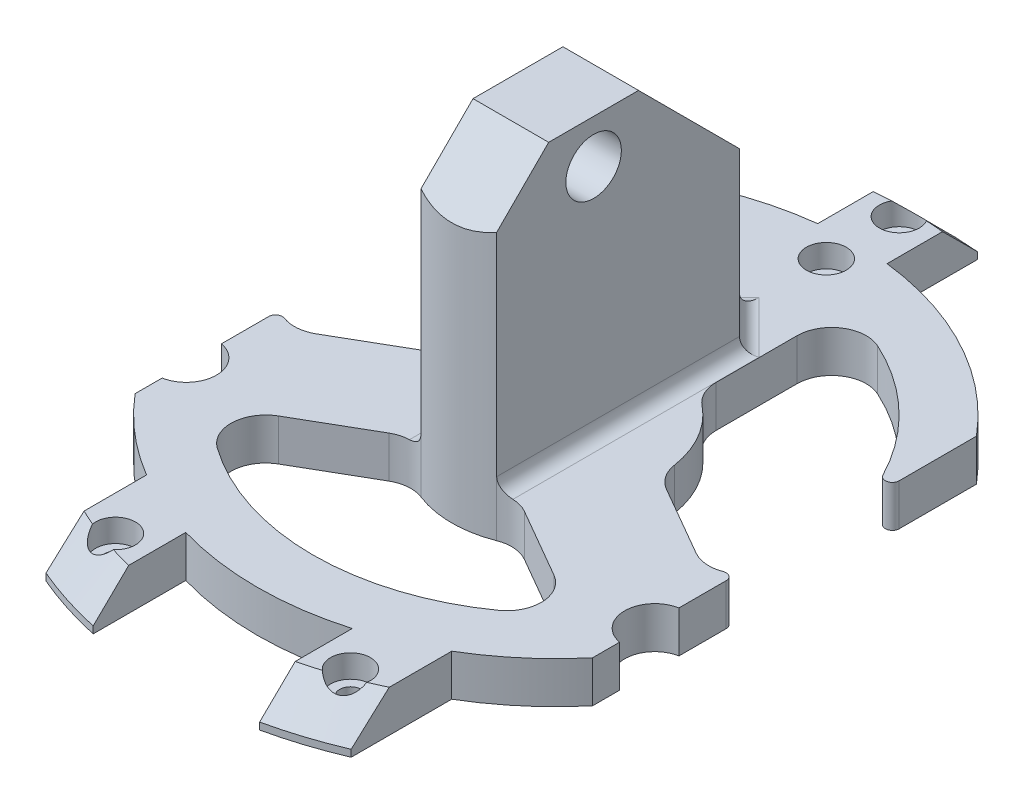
SolidWorks part; units mm, degrees
ref_plane "Alzado" through (0, 0, 0) normal (0, 0, 1) x (1, 0, 0)
ref_plane "Planta" through (0, 0, 0) normal (0, 1, 0) x (1, 0, 0)
ref_plane "Vista lateral" through (0, 0, 0) normal (1, 0, 0) x (0, 0, -1)
sketch "Croquis2" plane through (0, 0, 0) normal (0, 1, 0) x (1, 0, 0)
  circle A0 centre (0, 0) radius 43.05
  dimension "D1" = 86.1
extrude "Saliente-Extruir1" add sketch "Croquis2" along normal blind 5
sketch "Croquis3" plane through (0, 5, 0) normal (0, 1, 0) x (1, 0, 0)
  line L0 (-5, 42.7587) -> (-5, 55.7763)
  line L1 (0, 0) -> (0, 50000) construction
  line L2 (5, 42.7587) -> (5, 55.7763)
  line L3 (-12, -41.3437) -> (-12, -54.6992)
  line L4 (-22, -51.4976) -> (-22, -37.0041)
  line L5 (-12, -48.0214) -> (-22, -48.0214) construction
  line L6 (-22, -48.0214) -> (-17, -48.0214) construction
  line L7 (-17, -48.0214) -> (-17, -28.883) construction
  line L8 (22, -51.4976) -> (22, -37.0041)
  line L9 (12, -41.3437) -> (12, -54.6992)
  circle A0 centre (0, 0) radius 43.05 construction
  arc A1 (-5, 55.7763) -> (5, 55.7763) centre (0, 0) cw
  arc A2 (-5, 42.7587) -> (5, 42.7587) centre (0, 0) cw
  circle A4 centre (0, 0) radius 43.05
  circle A5 centre (0, 0) radius 43.05 construction
  arc A6 (-12, -54.6992) -> (-22, -51.4976) centre (0, 0) cw
  arc A7 (-22, -37.0041) -> (-12, -41.3437) centre (0, 0) ccw
  arc A8 (22, -37.0041) -> (12, -41.3437) centre (0, 0) cw
  arc A9 (12, -54.6992) -> (22, -51.4976) centre (0, 0) ccw
  dimension "D2" = 56
  dimension "D4" = 17
  dimension "D1" = 10
  dimension "D3" = 0
  dimension "D5" = 10
extrude "Saliente-Extruir2" add sketch "Croquis3" against normal up to surface (5 mm away)
sketch "Croquis5" plane through (0, 0, 0) normal (1, 0, 0) x (0, 0, -1)
  line L0 (56, 0) -> (51, 5)
  line L1 (42.7587, 5) -> (55.7763, 5) construction
  line L2 (51, 5) -> (56, 5)
  line L3 (56, 5) -> (56, 0)
  line L4 (0, 0) -> (0, 50000) construction
  dimension "D1" = 45
revolve "Cortar-Revolución1" cut sketch "Croquis5" angle 360 about L4
sketch "Croquis7" plane through (0, 0, 0) normal (0, -1, 0) x (1, 0, 0)
  line L0 (-19.8681, 20.1311) -> (-9.7708, 14.3014)
  line L1 (9.7708, 14.3014) -> (19.8681, 20.1311)
  line L2 (7.5, -15.6125) -> (7.5, -27.2718)
  line L3 (27.3681, 7.1407) -> (17.2708, 1.3111)
  line L4 (-17.2708, 1.3111) -> (-27.3681, 7.1407)
  line L5 (-7.5, -27.2718) -> (-7.5, -15.6125)
  line L6 (-32.9782, 6.7255) -> (-32.9782, -10) construction
  line L7 (-32.9782, -11.7234) -> (-32.9782, -10) construction
  line L8 (-32.9782, 10) -> (-32.9782, 24.0562)
  line L9 (-32.9782, -24.0562) -> (-32.9782, -11.7234)
  line L10 (-32.9782, 10) -> (-32.9782, 6.7255)
  line L11 (-32.9782, -24.0562) -> (-32.9782, -27.672)
  line L12 (-32.9782, 24.0562) -> (-32.9782, 27.672)
  line L13 (0, 0) -> (0, 50000) construction
  line L14 (32.9782, 27.672) -> (32.9782, 6.7255)
  line L15 (32.9782, 6.7255) -> (32.9782, -11.7234) construction
  line L16 (32.9782, -11.7234) -> (32.9782, -27.672)
  arc A0 (-5.4531, 13.9737) -> (5.4531, 13.9737) centre (0, 0) cw
  arc A1 (5.4531, 13.9737) -> (9.7708, 14.3014) centre (7.2708, 18.6316) ccw
  arc A2 (20.2627, 28.5381) -> (19.8681, 20.1311) centre (17.3681, 24.4612) cw
  arc A3 (-20.2627, 28.5381) -> (-19.8681, 20.1311) centre (-17.3681, 24.4612) ccw
  arc A4 (-20.2627, 28.5381) -> (20.2627, 28.5381) centre (0, 0) cw
  arc A5 (-9.7708, 14.3014) -> (-5.4531, 13.9737) centre (-7.2708, 18.6316) ccw
  arc A6 (14.5833, -31.8171) -> (7.5, -27.2718) centre (12.5, -27.2718) cw
  arc A7 (32.9782, -11.7234) -> (14.5833, -31.8171) centre (0, 0) cw
  arc A8 (32.9782, 6.7255) -> (27.3681, 7.1407) centre (29.8681, 2.8106) ccw
  arc A9 (17.2708, 1.3111) -> (14.8281, -2.2643) centre (19.7708, -3.0191) ccw
  arc A10 (14.8281, -2.2643) -> (9.375, -11.7094) centre (0, 0) cw
  arc A11 (9.375, -11.7094) -> (7.5, -15.6125) centre (12.5, -15.6125) ccw
  arc A12 (-32.9782, 6.7255) -> (-27.3681, 7.1407) centre (-29.8681, 2.8106) cw
  arc A13 (-14.5833, -31.8171) -> (-32.9782, -11.7234) centre (0, 0) cw
  arc A14 (-14.5833, -31.8171) -> (-7.5, -27.2718) centre (-12.5, -27.2718) ccw
  arc A15 (-7.5, -15.6125) -> (-9.375, -11.7094) centre (-12.5, -15.6125) ccw
  arc A16 (-9.375, -11.7094) -> (-14.8281, -2.2643) centre (0, 0) cw
  arc A17 (-14.8281, -2.2643) -> (-17.2708, 1.3111) centre (-19.7708, -3.0191) ccw
  arc A18 (-22, 37.0041) -> (-5, -42.7587) centre (0, 0) ccw construction
  arc A19 (-32.9782, 27.672) -> (-32.9782, -27.672) centre (0, 0) ccw
  arc A20 (-34.8461, 3.279) -> (-32.9782, 6.7255) centre (-29.8681, 2.8106) cw construction
  arc A21 (-32.9782, -11.7234) -> (-34.8461, 3.279) centre (0, 0) cw construction
  arc A22 (32.9782, 27.672) -> (32.9782, -27.672) centre (0, 0) cw
  arc A23 (34.8461, 3.279) -> (32.9782, 6.7255) centre (29.8681, 2.8106) ccw construction
  arc A24 (34.8461, 3.279) -> (32.9782, -11.7234) centre (0, 0) cw construction
  point P41 (0, 0)
extrude "Cortar-Extruir1" cut sketch "Croquis7" against normal through all
fillet "Redondeo1" radius 1 4 edges at (32.9782, 2.5, 6.7255) (32.9782, 2.5, -11.7234) (-32.9782, 2.5, 6.7255) (-32.9782, 2.5, -11.7234)
sketch "Croquis8" plane through (0, 5, 0) normal (0, 1, 0) x (1, 0, 0)
  circle A1 centre (33.775, -19.5) radius 4.35
  circle A2 centre (-33.775, -19.5) radius 4.35
  dimension "D1" = 8.7
extrude "Cortar-Extruir2" cut sketch "Croquis8" against normal through all
sketch "Croquis9" plane through (0, 5, 0) normal (0, 1, 0) x (1, 0, 0)
  circle A2 centre (0, 39) radius 1.55
  circle A3 centre (0, 49.53) radius 1.55
  circle A4 centre (0, 0) radius 49.53 construction
  circle A8 centre (-16.9385, -46.5383) radius 1.55
  circle A10 centre (16.9385, -46.5383) radius 1.55
  dimension "D1" = 99.06
extrude "Cortar-Extruir4" cut sketch "Croquis9" against normal through all
sketch "Croquis10" plane through (0, 5, 0) normal (0, 1, 0) x (1, 0, 0)
  circle A0 centre (0, 49.53) radius 2.875
  circle A1 centre (0, 39) radius 2.875
  circle A2 centre (-16.9385, -46.5383) radius 2.875
  circle A3 centre (16.9385, -46.5383) radius 2.875
  dimension "D1" = 5.75
extrude "Cortar-Extruir5" cut sketch "Croquis10" against normal blind 3.3
sketch "Croquis11" plane through (0, 5, 0) normal (0, 1, 0) x (1, 0, 0)
  line L4 (5.4531, -13.9737) -> (5.4531, 21.0263)
  line L5 (5.4531, 21.0263) -> (0, 26.4794)
  line L6 (0, 26.4794) -> (-5.4531, 21.0263)
  line L7 (-5.4531, 21.0263) -> (-5.4531, -13.9737)
  arc A4 (-5.4531, -13.9737) -> (5.4531, -13.9737) centre (0, 0) ccw construction
  arc A5 (-5.4531, -13.9737) -> (5.4531, -13.9737) centre (0, 0) ccw
  dimension "D1" = 35
extrude "Saliente-Extruir3" add sketch "Croquis11" along normal blind 40
sketch "Croquis12" plane through (5.4531, 0, 0) normal (1, 0, 0) x (0, 0, -1)
  line L1 (-15, 45) -> (-15, 0) construction
  line L2 (6.4794, 45) -> (26.4794, 25)
  line L3 (-13.9737, 45) -> (21.0263, 45) construction
  line L4 (26.4794, 45) -> (26.4794, 5) construction
  line L5 (6.4794, 45) -> (26.4794, 45)
  line L6 (21.0263, 45) -> (26.4794, 45) construction
  line L7 (26.4794, 45) -> (26.4794, 25)
  line L8 (0, 39) -> (0, -49961) construction
  line L9 (-26.4794, 45) -> (-26.4794, 25)
  line L10 (-6.4794, 45) -> (-26.4794, 45)
  line L11 (-6.4794, 45) -> (-26.4794, 25)
  line L12 (16.5346, 5) -> (27.672, 5) construction
  circle A1 centre (0, 38.75) radius 4
  arc A3 (-2.1682, 36.6766) -> (2.1682, 40.8234) centre (0, 38.75) ccw construction
  dimension "D3" = 8
  dimension "D1" = 33.75
  dimension "D2" = 15
  dimension "D4" = 45
extrude "Cortar-Extruir6" cut sketch "Croquis12" against normal through all
fillet "Redondeo2" radius 2 4 edges at (-5.4531, 5, -3.5263) (-2.7266, 5, -23.7529) (2.7266, 5, -23.7529) (5.4531, 5, -3.5263)
sketch "Croquis13" plane through (0, 0, 0) normal (0, -1, 0) x (1, 0, 0)
  line L0 (9.7708, 14.3014) -> (19.8681, 20.1311) construction
  line L1 (-19.8681, 20.1311) -> (-9.7708, 14.3014) construction
  line L2 (9.7708, 14.3014) -> (19.8681, 20.1311)
  line L3 (-19.8681, 20.1311) -> (-9.7708, 14.3014)
  line L16 (-32.9782, 27.672) -> (-32.9782, 23.7764)
  line L17 (-32.9782, 15.2236) -> (-32.9782, 8.4273)
  line L18 (-27.3681, 7.1407) -> (-17.2708, 1.3111)
  line L19 (-7.5, -15.6125) -> (-7.5, -27.2718)
  line L20 (-32.9782, -16.5346) -> (-32.9782, -27.672)
  line L21 (-5, -42.7587) -> (-5, -55.7763)
  line L22 (5, -55.7763) -> (5, -42.7587)
  line L23 (32.9782, -27.672) -> (32.9782, -16.5346)
  line L24 (7.5, -27.2718) -> (7.5, -15.6125)
  line L25 (17.2708, 1.3111) -> (27.3681, 7.1407)
  line L26 (32.9782, 8.4273) -> (32.9782, 15.2236)
  line L27 (32.9782, 23.7764) -> (32.9782, 27.672)
  line L28 (22, 37.0041) -> (22, 51.4976)
  line L29 (12, 54.6992) -> (12, 41.3437)
  line L30 (-12, 41.3437) -> (-12, 54.6992)
  line L31 (-22, 51.4976) -> (-22, 37.0041)
  line L32 (-32.9782, 27.672) -> (-32.9782, 23.7764)
  line L33 (-32.9782, 15.2236) -> (-32.9782, 8.4273)
  line L34 (-27.3681, 7.1407) -> (-17.2708, 1.3111)
  line L35 (-7.5, -15.6125) -> (-7.5, -27.2718)
  line L36 (-32.9782, -16.5346) -> (-32.9782, -27.672)
  line L37 (-5, -42.7587) -> (-5, -55.7763)
  line L38 (5, -55.7763) -> (5, -42.7587)
  line L39 (32.9782, -27.672) -> (32.9782, -16.5346)
  line L40 (7.5, -27.2718) -> (7.5, -15.6125)
  line L41 (17.2708, 1.3111) -> (27.3681, 7.1407)
  line L42 (32.9782, 8.4273) -> (32.9782, 15.2236)
  line L43 (32.9782, 23.7764) -> (32.9782, 27.672)
  line L44 (22, 37.0041) -> (22, 51.4976)
  line L45 (12, 54.6992) -> (12, 41.3437)
  line L46 (-12, 41.3437) -> (-12, 54.6992)
  line L47 (-22, 51.4976) -> (-22, 37.0041)
  circle A0 centre (0, -49.53) radius 1.55 construction
  circle A1 centre (0, -39) radius 1.55 construction
  circle A2 centre (16.9385, 46.5383) radius 1.55 construction
  circle A3 centre (-16.9385, 46.5383) radius 1.55 construction
  circle A4 centre (0, -49.53) radius 1.55
  circle A5 centre (0, -39) radius 1.55
  circle A6 centre (16.9385, 46.5383) radius 1.55
  circle A7 centre (-16.9385, 46.5383) radius 1.55
  arc A8 (19.8681, 20.1311) -> (20.2627, 28.5381) centre (17.3681, 24.4612) ccw construction
  arc A9 (5.4531, 13.9737) -> (9.7708, 14.3014) centre (7.2708, 18.6316) ccw construction
  arc A10 (5.4531, 13.9737) -> (-5.4531, 13.9737) centre (0, 0) ccw construction
  arc A11 (-9.7708, 14.3014) -> (-5.4531, 13.9737) centre (-7.2708, 18.6316) ccw construction
  arc A12 (-20.2627, 28.5381) -> (-19.8681, 20.1311) centre (-17.3681, 24.4612) ccw construction
  arc A13 (20.2627, 28.5381) -> (-20.2627, 28.5381) centre (0, 0) ccw construction
  arc A14 (19.8681, 20.1311) -> (20.2627, 28.5381) centre (17.3681, 24.4612) ccw
  arc A15 (5.4531, 13.9737) -> (9.7708, 14.3014) centre (7.2708, 18.6316) ccw
  arc A16 (5.4531, 13.9737) -> (-5.4531, 13.9737) centre (0, 0) ccw
  arc A17 (-9.7708, 14.3014) -> (-5.4531, 13.9737) centre (-7.2708, 18.6316) ccw
  arc A18 (-20.2627, 28.5381) -> (-19.8681, 20.1311) centre (-17.3681, 24.4612) ccw
  arc A19 (20.2627, 28.5381) -> (-20.2627, 28.5381) centre (0, 0) ccw
  arc A26 (-32.9782, 15.2236) -> (-32.9782, 23.7764) centre (-33.775, 19.5) ccw
  arc A27 (-32.9782, 8.4273) -> (-31.6265, 7.4911) centre (-31.9782, 8.4273) ccw
  arc A28 (-27.3681, 7.1407) -> (-31.6265, 7.4911) centre (-29.8681, 2.8106) ccw
  arc A29 (-14.8281, -2.2643) -> (-17.2708, 1.3111) centre (-19.7708, -3.0191) ccw
  arc A30 (-14.8281, -2.2643) -> (-9.375, -11.7094) centre (0, 0) ccw
  arc A31 (-7.5, -15.6125) -> (-9.375, -11.7094) centre (-12.5, -15.6125) ccw
  arc A32 (-14.5833, -31.8171) -> (-7.5, -27.2718) centre (-12.5, -27.2718) ccw
  arc A33 (-31.0899, -16.0753) -> (-14.5833, -31.8171) centre (0, 0) ccw
  arc A34 (-31.0899, -16.0753) -> (-32.9782, -16.5346) centre (-31.9782, -16.5346) ccw
  arc A35 (-32.9782, -27.672) -> (-5, -42.7587) centre (0, 0) ccw
  arc A36 (-5, -55.7763) -> (5, -55.7763) centre (0, 0) ccw
  arc A37 (5, -42.7587) -> (32.9782, -27.672) centre (0, 0) ccw
  arc A38 (32.9782, -16.5346) -> (31.0899, -16.0753) centre (31.9782, -16.5346) ccw
  arc A39 (14.5833, -31.8171) -> (31.0899, -16.0753) centre (0, 0) ccw
  arc A40 (7.5, -27.2718) -> (14.5833, -31.8171) centre (12.5, -27.2718) ccw
  arc A41 (9.375, -11.7094) -> (7.5, -15.6125) centre (12.5, -15.6125) ccw
  arc A42 (9.375, -11.7094) -> (14.8281, -2.2643) centre (0, 0) ccw
  arc A43 (17.2708, 1.3111) -> (14.8281, -2.2643) centre (19.7708, -3.0191) ccw
  arc A44 (31.6265, 7.4911) -> (27.3681, 7.1407) centre (29.8681, 2.8106) ccw
  arc A45 (31.6265, 7.4911) -> (32.9782, 8.4273) centre (31.9782, 8.4273) ccw
  arc A46 (32.9782, 23.7764) -> (32.9782, 15.2236) centre (33.775, 19.5) ccw
  arc A47 (32.9782, 27.672) -> (22, 37.0041) centre (0, 0) ccw
  arc A48 (22, 51.4976) -> (12, 54.6992) centre (0, 0) ccw
  arc A49 (12, 41.3437) -> (-12, 41.3437) centre (0, 0) ccw
  arc A50 (-12, 54.6992) -> (-22, 51.4976) centre (0, 0) ccw
  arc A51 (-22, 37.0041) -> (-32.9782, 27.672) centre (0, 0) ccw
  arc A52 (-32.9782, 15.2236) -> (-32.9782, 23.7764) centre (-33.775, 19.5) ccw
  arc A53 (-32.9782, 8.4273) -> (-31.6265, 7.4911) centre (-31.9782, 8.4273) ccw
  arc A54 (-27.3681, 7.1407) -> (-31.6265, 7.4911) centre (-29.8681, 2.8106) ccw
  arc A55 (-14.8281, -2.2643) -> (-17.2708, 1.3111) centre (-19.7708, -3.0191) ccw
  arc A56 (-14.8281, -2.2643) -> (-9.375, -11.7094) centre (0, 0) ccw
  arc A57 (-7.5, -15.6125) -> (-9.375, -11.7094) centre (-12.5, -15.6125) ccw
  arc A58 (-14.5833, -31.8171) -> (-7.5, -27.2718) centre (-12.5, -27.2718) ccw
  arc A59 (-31.0899, -16.0753) -> (-14.5833, -31.8171) centre (0, 0) ccw
  arc A60 (-31.0899, -16.0753) -> (-32.9782, -16.5346) centre (-31.9782, -16.5346) ccw
  arc A61 (-32.9782, -27.672) -> (-5, -42.7587) centre (0, 0) ccw
  arc A62 (-5, -55.7763) -> (5, -55.7763) centre (0, 0) ccw
  arc A63 (5, -42.7587) -> (32.9782, -27.672) centre (0, 0) ccw
  arc A64 (32.9782, -16.5346) -> (31.0899, -16.0753) centre (31.9782, -16.5346) ccw
  arc A65 (14.5833, -31.8171) -> (31.0899, -16.0753) centre (0, 0) ccw
  arc A66 (7.5, -27.2718) -> (14.5833, -31.8171) centre (12.5, -27.2718) ccw
  arc A67 (9.375, -11.7094) -> (7.5, -15.6125) centre (12.5, -15.6125) ccw
  arc A68 (9.375, -11.7094) -> (14.8281, -2.2643) centre (0, 0) ccw
  arc A69 (17.2708, 1.3111) -> (14.8281, -2.2643) centre (19.7708, -3.0191) ccw
  arc A70 (31.6265, 7.4911) -> (27.3681, 7.1407) centre (29.8681, 2.8106) ccw
  arc A71 (31.6265, 7.4911) -> (32.9782, 8.4273) centre (31.9782, 8.4273) ccw
  arc A72 (32.9782, 23.7764) -> (32.9782, 15.2236) centre (33.775, 19.5) ccw
  arc A73 (32.9782, 27.672) -> (22, 37.0041) centre (0, 0) ccw
  arc A74 (22, 51.4976) -> (12, 54.6992) centre (0, 0) ccw
  arc A75 (12, 41.3437) -> (-12, 41.3437) centre (0, 0) ccw
  arc A76 (-12, 54.6992) -> (-22, 51.4976) centre (0, 0) ccw
  arc A77 (-22, 37.0041) -> (-32.9782, 27.672) centre (0, 0) ccw
  dimension "D1" = 0
extrude "Saliente-Extruir4" add sketch "Croquis13" along normal blind 1
